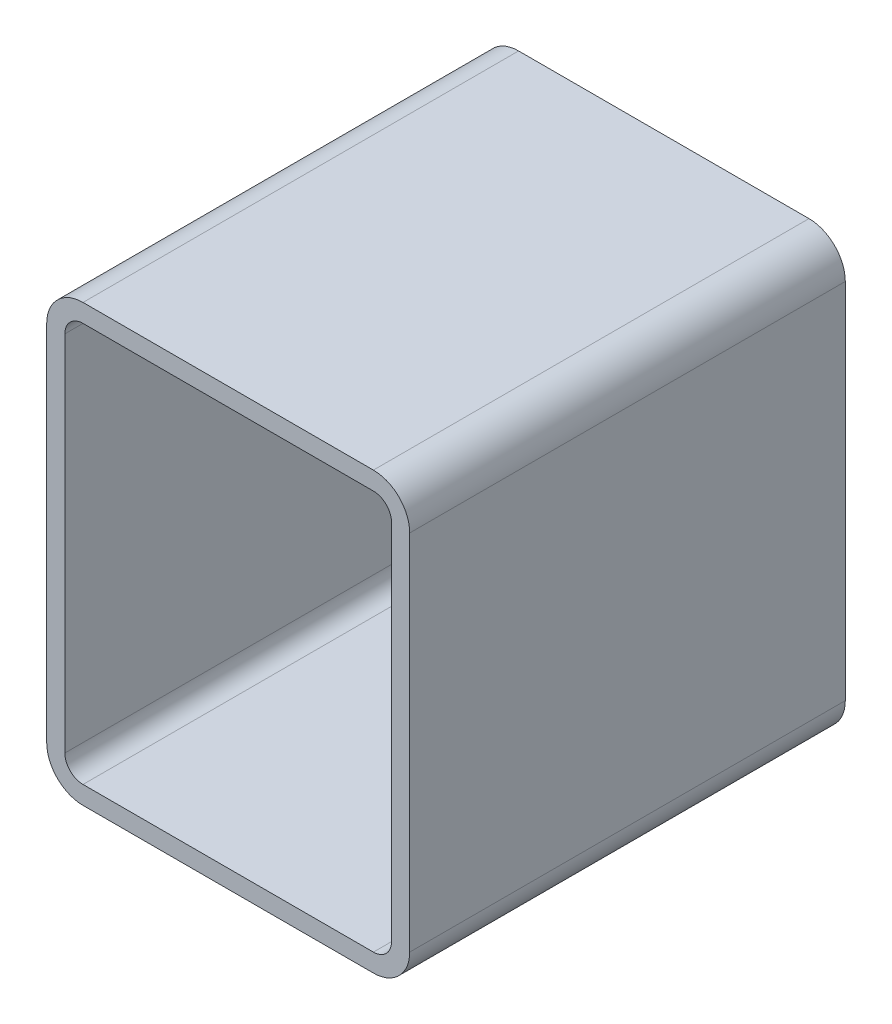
SolidWorks part; units mm, degrees
ref_plane "Front Plane" through (0, 0, 0) normal (0, 0, 1) x (1, 0, 0)
ref_plane "Top Plane" through (0, 0, 0) normal (0, 1, 0) x (1, 0, 0)
ref_plane "Right Plane" through (0, 0, 0) normal (1, 0, 0) x (0, 0, -1)
sketch "Sketch1" plane through (0, 0, 0) normal (0, 0, 1) x (1, 0, 0)
sketch_block_instance "HSS12x10x0.500-1"
sketch_block "HSS12x10x0.500"
extrude "Boss-Extrude1" add sketch "Sketch1" along normal blind 304.8
